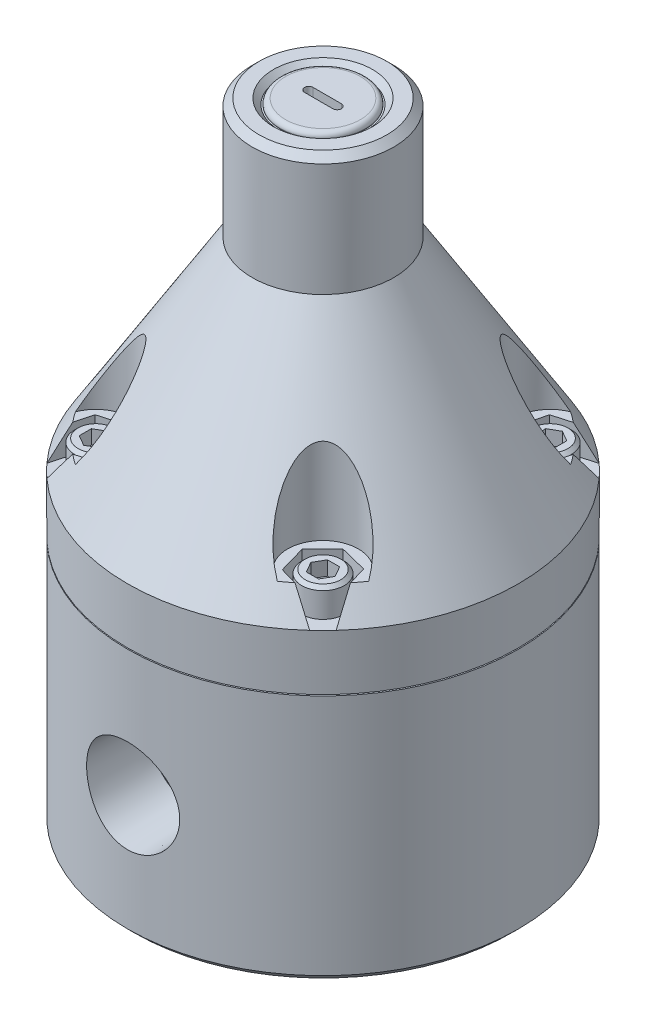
SolidWorks part; units mm, degrees
ref_plane "Front Plane" through (0, 0, 0) normal (0, 0, 1) x (1, 0, 0)
ref_plane "Top Plane" through (0, 0, 0) normal (0, 1, 0) x (1, 0, 0)
ref_plane "Right Plane" through (0, 0, 0) normal (1, 0, 0) x (0, 0, -1)
sketch "Sketch1" plane through (0, 0, 0) normal (0, 1, 0) x (1, 0, 0)
  circle A0 centre (0, 0) radius 43.815
  dimension "D1" = 87.63
extrude "Extrude1" add sketch "Sketch1" along normal blind 140.97
sketch "Sketch2" plane through (0, 0, 0) normal (0, 0, 1) x (1, 0, 0)
  line L0 (0, 0) -> (0, 140.97) construction
  line L1 (43.815, 140.97) -> (-43.815, 140.97) construction
  line L2 (-43.815, 56.134) -> (-43.815, 68.58)
  line L3 (-43.815, 56.134) -> (-30.226, 56.134)
  line L4 (-30.226, 56.134) -> (-30.226, 55.88)
  line L6 (-30.226, 55.88) -> (-49.4473, 55.88)
  line L7 (-49.4473, 55.88) -> (-49.4473, 147.034)
  line L8 (-49.4473, 147.034) -> (-15.875, 147.034)
  line L9 (-15.875, 147.034) -> (-15.875, 114.046)
  line L10 (-15.875, 114.046) -> (-43.815, 68.58)
  line L12 (-43.815, 0) -> (43.815, 0) construction
  dimension "D1" = 43.815
  dimension "D2" = 55.88
  dimension "D3" = 0.254
  dimension "D4" = 30.226
  dimension "D5" = 15.875
  dimension "D6" = 68.58
  dimension "D7" = 26.924
revolve "Cut-Revolve1" cut sketch "Sketch2" angle 360 about L0
ref_plane "Plane1" through (0, 140.97, 0) normal (0, 1, 0) x (-1, 0, 0)
sketch "Sketch3" plane through (0, 140.97, 0) normal (0, 1, 0) x (-1, 0, 0)
  circle A0 centre (0, 0) radius 11.1125
  dimension "D1" = 22.225
extrude "Extrude2" cut sketch "Sketch3" against normal blind 1.27 draft 45
chamfer "Chamfer1" distance 1.5748 angle 45 2 edges at (0, 0, 43.815) (0, 140.97, 15.875)
sketch "Sketch4" plane through (0, 140.97, 0) normal (0, 1, 0) x (-1, 0, 0)
  circle A0 centre (0, 0) radius 9.525
  dimension "D1" = 19.05
extrude "Extrude3" add sketch "Sketch4" against normal up to surface (1.27 mm away)
fillet "Fillet1" radius 1.143 1 edges at (0, 140.97, 9.525)
sketch "Sketch5" plane through (0, 140.97, 0) normal (0, 1, 0) x (-1, 0, 0)
  line L0 (-3.175, 0) -> (3.175, 0) construction
  line L1 (3.175, 0.9652) -> (-3.175, 0.9652)
  line L2 (-3.175, -0.9652) -> (3.175, -0.9652)
  arc A0 (-3.175, 0.9652) -> (-3.175, -0.9652) centre (-3.175, 0) ccw
  arc A1 (3.175, -0.9652) -> (3.175, 0.9652) centre (3.175, 0) ccw
  dimension "D1" = 3.175
  dimension "D2" = 6.35
  dimension "D3" = 0.9652
  dimension "D4" = 0.9652
extrude "Extrude4" cut sketch "Sketch5" against normal blind 3.302 draft 1
ref_plane "Plane2" through (0, 74.93, 0) normal (0, 1, 0) x (-1, 0, 0)
sketch "Sketch6" plane through (0, 74.93, 0) normal (0, 1, 0) x (-1, 0, 0)
  line L0 (0, 0) -> (-43.815, 0) construction
  line L1 (0, 0) -> (-30.9819, 30.9819) construction
  circle A0 centre (0, 0) radius 43.815 construction
  circle A1 centre (0, 0) radius 36.0045 construction
  circle A2 centre (-25.459, 25.459) radius 7.9375
  dimension "D1" = 72.009
  dimension "D2" = 15.875
extrude "Extrude5" cut sketch "Sketch6" along normal blind 22.86
sketch "Sketch8" plane through (0, 74.93, 0) normal (0, 1, 0) x (-1, 0, 0)
  line L0 (0, 0) -> (-30.9819, 30.9819) construction
  line L1 (-30.9819, 19.758) -> (-19.9362, 31.1601) construction
  line L2 (-30.9819, 30.9819) -> (-39.3973, 39.3973) construction
  line L3 (-29.9486, 20.8246) -> (-23.6903, 19.2537)
  line L4 (-23.6903, 19.2537) -> (-19.2007, 23.8882)
  line L5 (-19.2007, 23.8882) -> (-20.9694, 30.0935)
  line L9 (-29.9486, 20.8246) -> (-33.5917, 33.5917)
  line L10 (-33.5917, 33.5917) -> (-20.9694, 30.0935)
  line L12 (-27.2278, 31.6643) -> (-31.7174, 27.0299)
  line L13 (-20.9694, 30.0935) -> (-27.2278, 31.6643)
  line L14 (-31.7174, 27.0299) -> (-29.9486, 20.8246)
  circle A0 centre (0, 0) radius 43.815 construction
  arc A1 (-32.876, 22.6318) -> (-22.6318, 32.876) centre (-25.459, 25.459) ccw construction
  arc A2 (-32.876, 22.6318) -> (-22.6318, 32.876) centre (-25.459, 25.459) ccw construction
  circle A3 centre (-25.459, 25.459) radius 5.588 construction
extrude "Extrude6" cut sketch "Sketch8" against normal blind 6.35
pattern_circular "CirPattern1" count 4 over 360 about axis through (0, 0, 0) along (0, 1, 0) of "Extrude5", "Extrude6"
sketch "Sketch9" plane through (0, 74.93, 0) normal (0, 1, 0) x (-1, 0, 0)
  line L0 (0, 0) -> (-25.459, 25.459) construction
  circle A0 centre (-25.459, 25.459) radius 4.7625
  dimension "D1" = 9.525
extrude "Extrude7" add sketch "Sketch9" against normal up to surface (6.35 mm away)
sketch "Sketch10" plane through (0, 74.93, 0) normal (0, 1, 0) x (-1, 0, 0)
  line L1 (-28.1871, 25.459) -> (-26.8231, 23.0964)
  line L2 (-26.8231, 23.0964) -> (-24.095, 23.0964)
  line L3 (-24.095, 23.0964) -> (-22.7309, 25.459)
  line L4 (-22.7309, 25.459) -> (-24.095, 27.8216)
  line L5 (-24.095, 27.8216) -> (-26.8231, 27.8216)
  line L6 (-26.8231, 27.8216) -> (-28.1871, 25.459)
  circle A0 centre (-25.459, 25.459) radius 2.3626 construction
extrude "Extrude8" cut sketch "Sketch10" against normal blind 3.175
pattern_circular "CirPattern2" count 4 over 360 about axis through (0, 0, 0) along (0, 1, 0) of "Extrude7", "Extrude8"
chamfer "Chamfer2" distance 0.762 angle 45 4 edges at (-25.459, 74.93, -30.2215) (30.2215, 74.93, -25.459) (25.459, 74.93, 30.2215) (-30.2215, 74.93, 25.459)
ref_plane "Plane3" through (0, 0, 43.815) normal (0, 0, 1) x (1, 0, 0)
sketch "Sketch11" plane through (0, 0, 43.815) normal (0, 0, 1) x (1, 0, 0)
  line L0 (0, -6.7756) -> (0, 147.7456) construction
  line L1 (-48.3989, 25.4) -> (47.2148, 25.4) construction
  line L2 (-42.2402, 0) -> (42.2402, 0) construction
  dimension "D1" = 25.4
hole_wizard "1/2 Rc Tapped Hole1" positions "3DSketch3" profile "Sketch14" size "1/2" standard "BSI"
sketch3d "3DSketch3"
  line L0 (0, -6.7756, 43.815) -> (0, 147.7456, 43.815) construction
  point P0 (0, 27.432, 43.815)
sketch "Sketch14" plane through (0, 27.432, 43.815) normal (1, 0, 0) x (0, -1, 0)
  line L0 (0, 0) -> (0, 27.7544)
  line L1 (8.75, 24.13) -> (0, 27.7544)
  line L2 (-8.75, 24.13) -> (0, 27.7544) construction
  line L3 (8.75, 24.13) -> (8.75, 14.986)
  line L4 (8.75, 14.986) -> (10.0093, 14.986)
  line L5 (10.0093, 14.986) -> (10.4771, 0)
  line L6 (-10.0093, 14.986) -> (-10.4771, 0) construction
  line L7 (10.4771, 0) -> (0, 0)
  line L8 (0, -6.35) -> (0, 107.95) construction
  line L11 (-8.75, 14.986) -> (-10.0093, 14.986) construction
  dimension "Tap Drill Dia." = 17.5
  dimension "Tap Drill Depth" = 24.13
  dimension "Thread Dia." = 20.9541
  dimension "Thread Angle" = 3.576
  dimension "Thread Depth" = 14.986
  dimension "Drill Angle" = 135
mirror "Mirror1" about plane through (0, 0, 0) normal (0, 0, 1) of "1/2 Rc Tapped Hole1"
